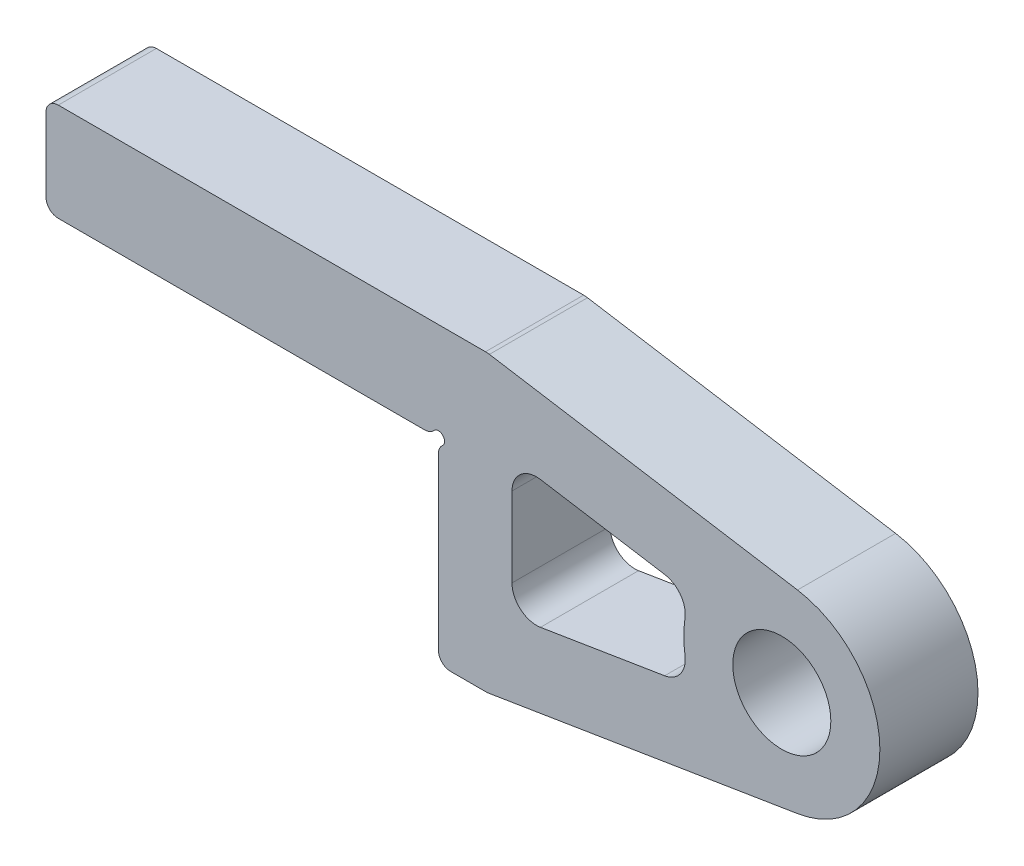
SolidWorks part; units mm, degrees
ref_plane "Front Plane" through (0, 0, 0) normal (0, 0, 1) x (1, 0, 0)
ref_plane "Top Plane" through (0, 0, 0) normal (0, 1, 0) x (1, 0, 0)
ref_plane "Right Plane" through (0, 0, 0) normal (1, 0, 0) x (0, 0, -1)
sketch "Sketch1" plane through (0, 0, 0) normal (0, 0, 1) x (1, 0, 0)
  line L1 (-25.4, -6.35) -> (25.4, -6.35)
  line L2 (-25.4, -6.35) -> (-25.4, 6.35)
  line L3 (-25.4, 6.35) -> (25.4, 6.35)
  line L4 (25.4, -6.35) -> (25.4, 6.35) construction
  line L5 (-25.4, -6.35) -> (25.4, 6.35) construction
  line L6 (-25.4, 6.35) -> (25.4, -6.35) construction
  line L7 (25.4, 6.35) -> (101.6, 6.35)
  line L8 (25.4, -6.35) -> (25.4, -31.75)
  line L9 (25.4, -31.75) -> (101.6, -31.75)
  line L10 (101.6, 6.35) -> (101.6, -31.75)
  point P0 (0, 0)
  dimension "D1" = 12.7
  dimension "D2" = 50.8
  dimension "D3" = 25.4
  dimension "D4" = 76.2
extrude "Boss-Extrude1" add sketch "Sketch1" along normal mid plane 12.7
hole_wizard "CBORE for #00 Binding Head Machine Screw1" positions "Sketch5" profile "Sketch6" counterbore size "#00" standard "ANSI Inch"
sketch "Sketch5" plane through (0, -6.35, 0) normal (0, -1, 0) x (-1, 0, 0)
  line L0 (0, -8.5785) -> (0, 8.0185) construction
  point P0 (12.7, 0)
  point P2 (-12.7, 0)
  dimension "D1" = 12.7
  dimension "D2" = 12.7
sketch "Sketch6" plane through (-12.7, -6.35, 0) normal (1, 0, 0) x (0, 0, -1)
  line L0 (0, 0) -> (0, 10.4102)
  line L1 (0, 10.4102) -> (1.4732, 9.525)
  line L2 (1.4732, 9.525) -> (1.4732, 2.794)
  line L3 (1.4732, 2.794) -> (2.794, 2.794)
  line L4 (2.794, 2.794) -> (2.794, 0)
  line L5 (2.794, 0) -> (0, 0)
  line L10 (0, 10.4102) -> (-1.4732, 9.525) construction
  line L11 (0, -6.35) -> (0, 107.95) construction
  dimension "Hole Dia." = 2.9464
  dimension "Hole Depth" = 9.525
  dimension "C'Bore Dia." = 5.588
  dimension "C'Bore Depth" = 2.794
  dimension "Drill Angle" = 118
sketch "Sketch7" plane through (0, 0, 6.35) normal (0, 0, 1) x (1, 0, 0)
  line L0 (101.6, 6.35) -> (-25.4, 6.35) construction
  line L1 (101.6, -31.75) -> (101.6, 6.35) construction
  line L2 (25.4, -31.75) -> (101.6, -31.75) construction
  line L3 (32.0027, -31.709) -> (71.8846, -25.236)
  line L4 (31.494, -31.75) -> (25.4, -31.75)
  line L5 (31.494, 6.35) -> (25.4, 6.35)
  line L6 (25.4, -6.35) -> (25.4, -31.75) construction
  line L7 (32.0027, 6.309) -> (71.8846, -0.164)
  line L8 (40.0113, -12.7) -> (108.8178, -12.7) construction
  line L9 (25.4, 6.35) -> (25.4, -6.35)
  line L10 (38.6087, -20.9872) -> (58.2208, -17.804)
  line L11 (25.4, -6.35) -> (25.4, -31.75)
  line L12 (34.925, -3.815) -> (34.925, -6.35) construction
  line L13 (34.925, -6.35) -> (34.925, -17.8532)
  line L14 (34.925, -7.5468) -> (34.925, -6.35)
  line L16 (38.6087, -4.4128) -> (58.2208, -7.596)
  line L17 (34.925, -3.815) -> (70.3587, -9.566) construction
  line L18 (34.925, -21.585) -> (70.3587, -15.834) construction
  line L19 (34.925, -6.35) -> (34.925, -21.585) construction
  line L20 (34.925, -21.585) -> (34.925, -21.585) construction
  line L21 (34.925, -3.815) -> (34.925, -3.815) construction
  circle A0 centre (69.85, -12.7) radius 6.35
  circle A1 centre (69.85, -12.7) radius 12.7
  arc A2 (31.494, -31.75) -> (32.0027, -31.709) centre (31.494, -28.575) ccw
  arc A3 (31.494, 6.35) -> (32.0027, 6.309) centre (31.494, 3.175) cw
  arc A4 (38.6087, -4.4128) -> (34.925, -7.5468) centre (38.1, -7.5468) ccw
  arc A6 (38.6087, -20.9872) -> (34.925, -17.8532) centre (38.1, -17.8532) cw
  arc A7 (34.925, -21.585) -> (34.925, -21.585) centre (34.925, -21.585) ccw construction
  arc A8 (34.925, -3.815) -> (34.925, -3.815) centre (34.925, -3.815) cw construction
  point P9 (31.75, -31.75)
  point P18 (31.75, -31.75)
  point P24 (31.75, 6.35)
  dimension "D1" = 12.7
  dimension "D4" = 6.35
  dimension "D5" = 3.175
  dimension "D7" = 25.4
  dimension "D8" = 3.175
  dimension "D2" = 19.05
  dimension "D3" = 31.75
  dimension "D6" = 9.525
extrude "Cut-Extrude1" cut sketch "Sketch7" against normal through all contours A3 L7 A1 L3 A2 M1 M5 M6 | A0 | A6 L10 A1 L16 A4 L14 L13
fillet "Fillet1" radius 3.175 2 edges at (58.2208, -17.804, 0) (58.2208, -7.596, 0)
fillet "Fillet2" radius 1.5875 3 edges at (25.4, -31.75, 0) (-25.4, -6.35, 0) (-25.4, 6.35, 0)
sketch "Sketch8" plane through (0, 0, 6.35) normal (0, 0, 1) x (1, 0, 0)
  circle A0 centre (25.4, -6.35) radius 0.7937
  dimension "D1" = 1.5875
extrude "Cut-Extrude2" cut sketch "Sketch8" against normal through all
fillet "Fillet3" radius 1.5875 2 edges at (24.6063, -6.35, 0) (25.4, -7.1437, 0)
